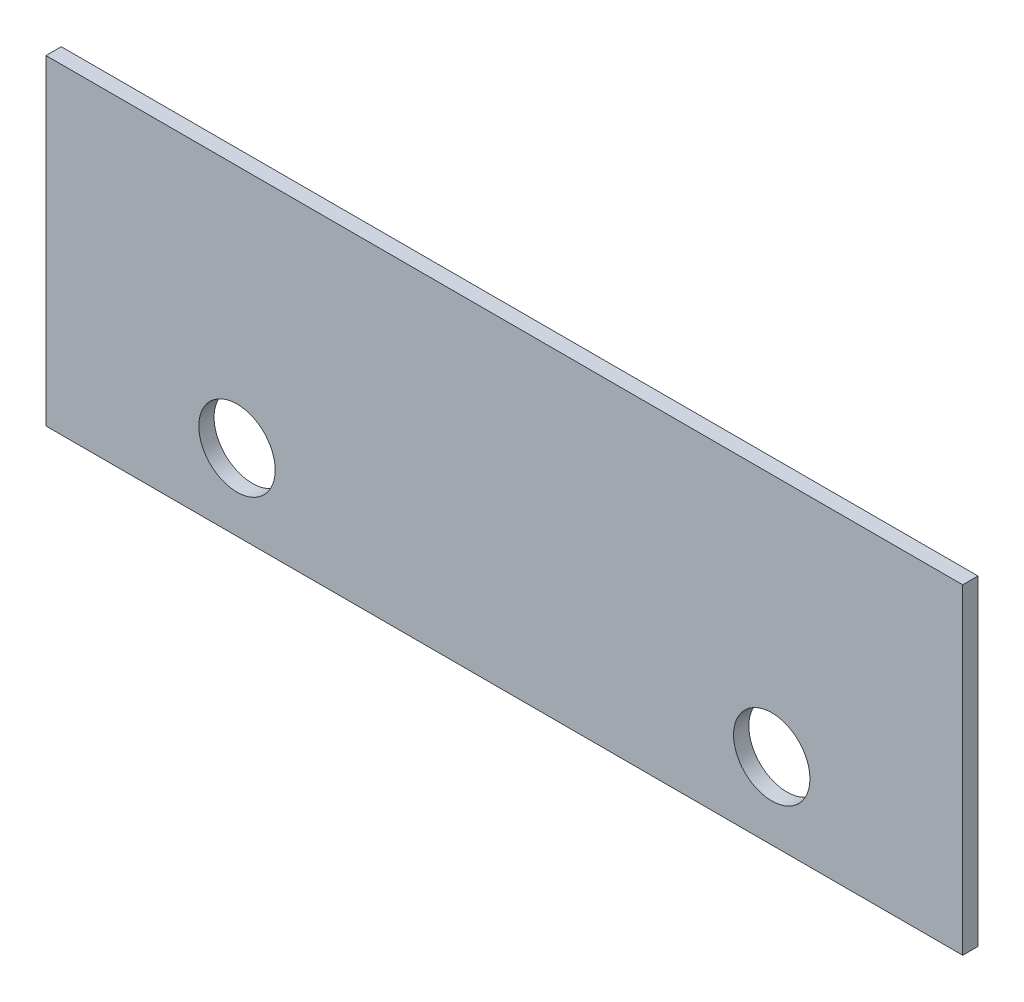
SolidWorks part; units mm, degrees
ref_plane "Face" through (0, 0, 0) normal (0, 0, 1) x (1, 0, 0)
ref_plane "Dessus" through (0, 0, 0) normal (0, 1, 0) x (1, 0, 0)
ref_plane "Droite" through (0, 0, 0) normal (1, 0, 0) x (0, 0, -1)
sketch "Esquisse1" plane through (0, 0, 0) normal (0, 0, 1) x (1, 0, 0)
  line L1 (-30, 10.5) -> (30, 10.5)
  line L2 (-30, 10.5) -> (-30, -10.5)
  line L3 (-30, -10.5) -> (30, -10.5)
  line L4 (30, 10.5) -> (30, -10.5)
  circle A0 centre (-17.5, -5.5) radius 2.5
  circle A1 centre (17.5, -5.5) radius 2.5
  dimension "D5" = 5
  dimension "D8" = 5
  dimension "D1" = 21
  dimension "D2" = 60
  dimension "D3" = 30
  dimension "D4" = 10.5
  dimension "D6" = 5
  dimension "D7" = 17.5
  dimension "D9" = 17.5
  dimension "D10" = 5
extrude "Base-Extrusion" add sketch "Esquisse1" against normal blind 1
